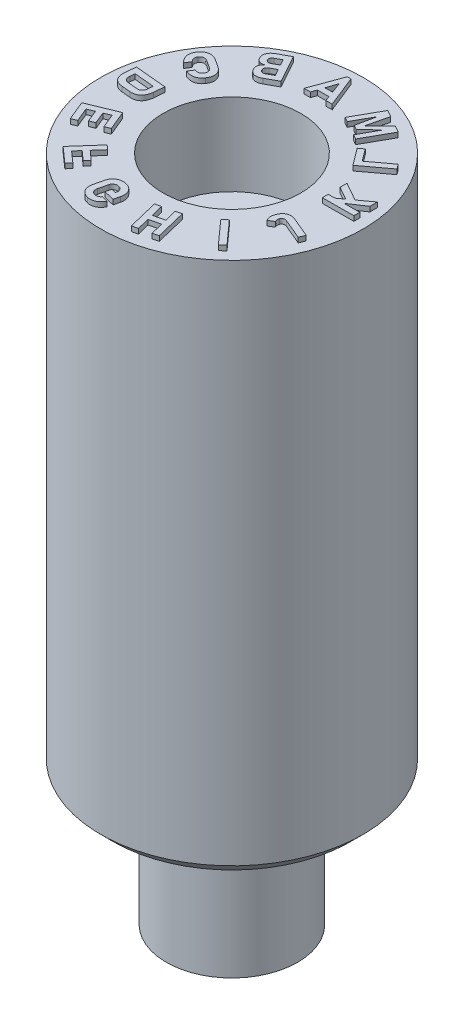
SolidWorks part; units mm, degrees
other "<M8L16-SetScrew>-<Chamfer1>" parameters "D10"=0.75
ref_plane "Front Plane" through (0, 0, 0) normal (0, 0, 1) x (1, 0, 0)
ref_plane "Top Plane" through (0, 0, 0) normal (0, 1, 0) x (1, 0, 0)
ref_plane "Right Plane" through (0, 0, 0) normal (1, 0, 0) x (0, 0, -1)
sketch "Sketch1" plane through (0, 0, 0) normal (0, 0, 1) x (1, 0, 0)
  line L0 (0, 0) -> (0, 20) construction
  line L1 (0, -17.985) -> (0, 17.985) construction
  line L2 (4, -32.7) -> (7.25, -32.7)
  line L4 (8, -31.95) -> (8, 0)
  line L5 (8, 0) -> (4.2, 0)
  line L6 (4.2, 0) -> (4.2, -5)
  line L7 (4.2, -5) -> (1.75, -5)
  line L8 (1.75, -5) -> (1.75, -22.7)
  line L9 (1.75, -22.7) -> (4, -22.7)
  line L10 (4, -22.7) -> (4, -32.7)
  line L11 (7.25, -32.7) -> (8, -31.95)
  point P6 (8, -32.7)
  dimension "D1" = 5
  dimension "D2" = 10
  dimension "D3" = 3.5
  dimension "D4" = 8.4
  dimension "D5" = 16
  dimension "D6" = 8
  dimension "D7" = 32.7
revolve "Revolve1" add sketch "Sketch1" angle 360 about L0
sketch "Sketch2" plane through (0, 0, 0) normal (0, 1, 0) x (1, 0, 0)
  line L0 (0, 0) -> (0, 8.4189) construction
  line L1 (0, 0) -> (3.9125, 7.4546) construction
  line L2 (0, 0) -> (6.9286, 4.7825) construction
  line L3 (0, 0) -> (8.3575, 1.0148) construction
  line L4 (0, 0) -> (7.8718, -2.9854) construction
  line L5 (0, 0) -> (5.5828, -6.3016) construction
  line L6 (0, 0) -> (2.0148, -8.1743) construction
  line L7 (0, 0) -> (-2.0148, -8.1743) construction
  line L8 (0, 0) -> (-5.5828, -6.3016) construction
  line L9 (0, 0) -> (-7.8718, -2.9854) construction
  line L10 (0, 0) -> (-8.3575, 1.0148) construction
  line L11 (0, 0) -> (-6.9286, 4.7825) construction
  line L12 (0, 0) -> (-3.9125, 7.4546) construction
  line L13 (6.1634, 3.8937) -> (5.9474, 4.1837)
  line L14 (5.9474, 4.1837) -> (4.688, 3.2459)
  line L15 (6.1926, 0.7435) -> (5.814, 0.4673)
  line L16 (4.6243, 2.7476) -> (6.1634, 3.8937)
  line L17 (4.6929, 3.2393) -> (4.1361, 3.9867)
  line L18 (4.1361, 3.9867) -> (3.8565, 3.7785)
  line L19 (3.8565, 3.7785) -> (4.6243, 2.7476)
  line L20 (-6.9372, -2.2143) -> (-6.8828, -2.3461)
  line L21 (3.2036, 6.4692) -> (2.7908, 6.7004)
  line L22 (2.7908, 6.7004) -> (1.8593, 5.0371)
  line L23 (1.8593, 5.0371) -> (2.1439, 4.8776)
  line L24 (2.1439, 4.8776) -> (2.8055, 6.0589)
  line L25 (5.814, 0.4673) -> (5.4001, 0.4644)
  line L26 (2.8055, 6.0589) -> (2.5544, 4.8913)
  line L27 (2.5544, 4.8913) -> (2.8312, 4.7363)
  line L28 (2.8312, 4.7363) -> (3.6837, 5.5389)
  line L29 (-2.705, 5.5245) -> (-2.482, 5.1205)
  line L30 (3.6837, 5.5389) -> (3.0342, 4.379)
  line L31 (3.0342, 4.379) -> (3.3188, 4.2196)
  line L32 (3.3188, 4.2196) -> (4.2502, 5.8829)
  line L33 (4.2502, 5.8829) -> (3.8374, 6.114)
  line L34 (3.8374, 6.114) -> (2.8925, 5.1702)
  line L35 (2.8925, 5.1702) -> (3.2036, 6.4692)
  line L36 (0.0051, 7.2452) -> (-0.2234, 7.2417)
  line L37 (-0.2234, 7.2417) -> (-0.9248, 5.3206)
  line L38 (-0.9248, 5.3206) -> (-0.5371, 5.3264)
  line L39 (-0.5371, 5.3264) -> (-0.4346, 5.634)
  line L40 (-0.0999, 6.6378) -> (0.1385, 5.9896)
  line L41 (0.3772, 5.3406) -> (0.7644, 5.3464)
  line L42 (0.7644, 5.3464) -> (0.0051, 7.2452)
  line L43 (0.1385, 5.9896) -> (-0.3183, 5.9827)
  line L44 (-5.2818, 0.7995) -> (-5.2817, 0.7994)
  line L45 (-0.4346, 5.634) -> (0.2654, 5.6446)
  line L46 (0.2654, 5.6446) -> (0.3772, 5.3406)
  line L47 (-2.482, 5.1205) -> (-2.8404, 4.9228)
  line L48 (-3.1778, 4.9966) -> (-3.1797, 5.0001)
  line L49 (-3.0634, 5.3268) -> (-2.705, 5.5245)
  line L50 (-5.7488, -2.1146) -> (-5.3521, -1.9511)
  line L51 (-2.8732, 5.8294) -> (-3.2317, 5.6317)
  line L52 (-3.4303, 5.9921) -> (-3.072, 6.1897)
  line L53 (-6.4787, -2.4153) -> (-6.0699, -2.2469)
  line L54 (-2.924, 6.669) -> (-3.6086, 6.2913)
  line L55 (-3.4724, 4.7776) -> (-3.4705, 4.7741)
  line L56 (-2.702, 4.6013) -> (-1.9976, 4.9899)
  line L57 (-4.1719, -4.468) -> (-3.6712, -3.9037)
  line L58 (-4.7036, -5.0672) -> (-4.4009, -4.7261)
  line L59 (-3.072, 6.1897) -> (-2.8732, 5.8294)
  line L60 (1.9018, -6.1847) -> (2.0889, -6.9547)
  line L61 (-1.9976, 4.9899) -> (-2.924, 6.669)
  line L62 (-4.7021, 3.8426) -> (-5.1435, 4.1295)
  line L63 (-5.9424, 3.0007) -> (-5.7379, 3.3152)
  line L64 (-5.3477, 3.8156) -> (-4.9064, 3.5287)
  line L65 (-5.2067, 2.9698) -> (-5.4111, 2.6553)
  line L66 (-5.6287, 0.8318) -> (-5.6548, 0.5518)
  line L67 (-6.0162, 0.2109) -> (-6.5786, 0.2633)
  line L68 (-6.8711, 0.6655) -> (-6.845, 0.9452)
  line L69 (-7.1581, 1.3375) -> (-7.1751, 1.1562)
  line L70 (-7.1751, 1.1562) -> (-7.2168, 0.7058)
  line L71 (-6.6029, -0.1107) -> (-6.0615, -0.1612)
  line L72 (-5.3071, 0.529) -> (-5.2482, 1.1595)
  line L73 (1.1507, -6.0092) -> (0.9672, -5.2541)
  line L74 (-5.2006, -5.0874) -> (-5.1027, -5.1741)
  line L75 (-6.845, 0.9452) -> (-5.6287, 0.8318)
  line L77 (-5.2482, 1.1595) -> (-7.1581, 1.3375)
  line L79 (-6.8, -2.5476) -> (-6.7998, -2.5476)
  line L81 (-5.1683, -1.4856) -> (-6.9372, -2.2143)
  line L82 (-5.3521, -1.9511) -> (-5.0014, -2.803)
  line L83 (-5.0014, -2.803) -> (-4.6803, -2.6707)
  line L84 (-4.6803, -2.6707) -> (-5.1683, -1.4856)
  line L86 (-6.0699, -2.2469) -> (-5.7743, -2.9647)
  line L87 (-5.7743, -2.9647) -> (-5.4532, -2.8324)
  line L88 (-5.4532, -2.8324) -> (-5.7488, -2.1146)
  line L90 (-6.8875, -2.3345) -> (-6.4491, -3.3994)
  line L91 (-6.4491, -3.3994) -> (-6.128, -3.267)
  line L92 (-6.128, -3.267) -> (-6.4787, -2.4153)
  line L95 (-4.9326, -5.3253) -> (-4.9325, -5.3252)
  line L96 (-3.6712, -3.9037) -> (-3.9393, -3.6658)
  line L97 (-3.9393, -3.6658) -> (-5.2006, -5.0874)
  line L98 (-4.4009, -4.7261) -> (-3.8424, -5.2216)
  line L99 (-3.8424, -5.2216) -> (-3.6134, -4.9633)
  line L100 (-3.6134, -4.9633) -> (-4.1719, -4.468)
  line L102 (-5.1027, -5.1741) -> (-4.2668, -5.9159)
  line L103 (-4.2668, -5.9159) -> (-4.0378, -5.658)
  line L104 (-4.0378, -5.658) -> (-4.7036, -5.0672)
  line L106 (-0.8932, -6.3528) -> (-0.8066, -5.9905)
  line L107 (-2.1537, -5.6247) -> (-2.2847, -6.1722)
  line L108 (-0.9771, -6.6349) -> (-1.3546, -6.5444)
  line L109 (-1.9226, -6.2591) -> (-1.7916, -5.7116)
  line L110 (-1.1675, -5.8989) -> (-1.1749, -5.9295)
  line L111 (-1.1749, -5.9295) -> (-1.4554, -5.862)
  line L112 (-1.4554, -5.862) -> (-1.536, -6.1988)
  line L113 (-1.536, -6.1988) -> (-0.8932, -6.3528)
  line L114 (2.0889, -6.9547) -> (2.44, -6.8695)
  line L115 (2.44, -6.8695) -> (1.9873, -5.0066)
  line L116 (1.9873, -5.0066) -> (1.6362, -5.0917)
  line L117 (1.6362, -5.0917) -> (1.8196, -5.8466)
  line L118 (1.069, -7.2026) -> (1.4199, -7.1171)
  line L119 (1.4199, -7.1171) -> (1.2329, -6.3473)
  line L120 (0.9672, -5.2541) -> (0.6163, -5.3396)
  line L121 (0.6163, -5.3396) -> (1.069, -7.2026)
  line L122 (1.2329, -6.3473) -> (1.9018, -6.1847)
  line L124 (1.8196, -5.8466) -> (1.1507, -6.0092)
  line L126 (3.7361, -3.8924) -> (3.4597, -4.1403)
  line L127 (3.4597, -4.1403) -> (4.7287, -5.5558)
  line L128 (4.7287, -5.5558) -> (5.0051, -5.308)
  line L129 (5.0051, -5.308) -> (3.7361, -3.8924)
  line L130 (4.9148, -2.7745) -> (5.2267, -2.5855)
  line L131 (5.5498, -2.211) -> (6.7531, -2.7157)
  line L132 (6.7531, -2.7157) -> (6.8975, -2.371)
  line L133 (6.8975, -2.371) -> (5.6929, -1.8659)
  line L134 (6.3638, 0.4711) -> (7.3057, 1.1003)
  line L135 (7.3057, 1.1003) -> (7.3025, 1.5534)
  line L136 (7.3025, 1.5534) -> (6.5176, 0.9806)
  line L138 (7.3126, 0.1175) -> (7.3101, 0.4775)
  line L139 (7.3101, 0.4775) -> (6.3638, 0.4711)
  line L140 (5.4001, 0.4644) -> (5.4026, 0.1044)
  line L141 (5.4026, 0.1044) -> (7.3126, 0.1175)
  line L143 (6.5176, 0.9806) -> (5.3919, 1.6205)
  line L144 (5.3919, 1.6205) -> (5.3948, 1.1935)
  line L145 (5.3948, 1.1935) -> (6.1926, 0.7435)
  line L146 (-0.3183, 5.9827) -> (-0.0999, 6.6378)
  circle A0 centre (0, 0) radius 5.405 construction
  spline S0 degree 3 poles (-2.8404, 4.9228) (-2.8729, 4.9052) (-2.9225, 4.8836) (-2.9909, 4.8764) (-3.037, 4.8809) (-3.0797, 4.8957) (-3.1328, 4.9293) (-3.1619, 4.9684) (-3.1778, 4.9966) knots 0 0 0 0 0.284391 0.406925 0.523436 0.636799 0.750157 1 1 1 1
  spline S1 degree 3 poles (-3.1797, 5.0001) (-3.1902, 5.0201) (-3.2046, 5.0505) (-3.2124, 5.093) (-3.2141, 5.1234) (-3.2105, 5.1528) (-3.2034, 5.1818) (-3.19, 5.2093) (-3.1732, 5.2361) (-3.1519, 5.2614) (-3.117, 5.2944) (-3.0855, 5.3143) (-3.0634, 5.3268) knots 0 0 0 0 0.172786 0.252535 0.328511 0.403241 0.477972 0.554742 0.634827 0.718587 0.806354 1 1 1 1
  spline S2 degree 3 poles (-3.2317, 5.6317) (-3.261, 5.616) (-3.306, 5.5961) (-3.3683, 5.5907) (-3.4105, 5.5961) (-3.4499, 5.6106) (-3.4988, 5.6439) (-3.5261, 5.6807) (-3.5411, 5.7076) knots 0 0 0 0 0.277608 0.399007 0.514088 0.628492 0.743694 1 1 1 1
  spline S3 degree 3 poles (-3.5411, 5.7076) (-3.5555, 5.7317) (-3.5687, 5.7713) (-3.5688, 5.8258) (-3.558, 5.8641) (-3.5391, 5.9007) (-3.4997, 5.9485) (-3.4594, 5.9757) (-3.4303, 5.9921) knots 0 0 0 0 0.242864 0.354019 0.467184 0.584636 0.709262 1 1 1 1
  spline S4 degree 3 poles (-3.6086, 6.2913) (-3.659, 6.2631) (-3.7299, 6.217) (-3.8099, 6.1429) (-3.8578, 6.0856) (-3.8962, 6.0256) (-3.9239, 5.9627) (-3.9414, 5.8976) (-3.9483, 5.8305) (-3.9456, 5.7617) (-3.9255, 5.6662) (-3.8969, 5.5968) (-3.8718, 5.5524) knots 0 0 0 0 0.195005 0.283131 0.366486 0.44606 0.522549 0.597223 0.672308 0.74896 0.828127 1 1 1 1
  spline S5 degree 3 poles (-3.8718, 5.5524) (-3.8548, 5.5214) (-3.825, 5.4781) (-3.7764, 5.4297) (-3.7377, 5.3996) (-3.696, 5.3751) (-3.6518, 5.3562) (-3.6047, 5.3441) (-3.5556, 5.3368) (-3.5042, 5.3361) (-3.4317, 5.3434) (-3.3774, 5.3578) (-3.3416, 5.3705) knots 0 0 0 0 0.171962 0.253412 0.332655 0.410313 0.487705 0.565742 0.64596 0.728643 0.814982 1 1 1 1
  spline S6 degree 3 poles (-3.3416, 5.3705) (-3.3738, 5.3463) (-3.4185, 5.307) (-3.4667, 5.2462) (-3.4951, 5.199) (-3.517, 5.15) (-3.5319, 5.0994) (-3.5396, 5.0476) (-3.5399, 4.9946) (-3.5338, 4.9407) (-3.5156, 4.8662) (-3.4921, 4.8123) (-3.4724, 4.7776) knots 0 0 0 0 0.180015 0.263899 0.345612 0.425257 0.503012 0.580312 0.658618 0.73897 0.822146 1 1 1 1
  spline S7 degree 3 poles (-3.4705, 4.7741) (-3.4462, 4.7287) (-3.4025, 4.6669) (-3.3313, 4.5989) (-3.2744, 4.5593) (-3.2136, 4.5288) (-3.1488, 4.5091) (-3.0805, 4.499) (-3.0091, 4.4996) (-2.935, 4.51) (-2.8294, 4.5378) (-2.7528, 4.5739) (-2.702, 4.6013) knots 0 0 0 0 0.172506 0.25189 0.329007 0.404278 0.479136 0.555323 0.634771 0.717862 0.805936 1 1 1 1
  spline S8 degree 3 poles (-4.4809, 2.8701) (-4.4618, 2.8998) (-4.435, 2.9445) (-4.4056, 3.0063) (-4.3873, 3.0516) (-4.3719, 3.0965) (-4.36, 3.1414) (-4.3513, 3.1859) (-4.3461, 3.2302) (-4.3444, 3.2739) (-4.3455, 3.3172) (-4.3499, 3.3598) (-4.3581, 3.4018) (-4.3684, 3.4434) (-4.3835, 3.4839) (-4.4006, 3.5241) (-4.4217, 3.5633) (-4.4456, 3.6019) (-4.473, 3.6394) (-4.5033, 3.676) (-4.5371, 3.7113) (-4.5737, 3.7457) (-4.6276, 3.7914) (-4.6716, 3.8225) (-4.7021, 3.8426) knots 0 0 0 0 0.093463 0.13776 0.180719 0.222737 0.263257 0.303434 0.342516 0.381193 0.419051 0.456928 0.494305 0.53222 0.570071 0.60851 0.64773 0.687578 0.728638 0.770358 0.813344 0.857642 0.903384 1 1 1 1
  spline S9 degree 3 poles (-5.1435, 4.1295) (-5.1741, 4.1493) (-5.2204, 4.1764) (-5.2835, 4.2079) (-5.33, 4.2271) (-5.376, 4.2434) (-5.4216, 4.2566) (-5.4669, 4.2664) (-5.5119, 4.2728) (-5.5564, 4.2762) (-5.6003, 4.2758) (-5.6433, 4.2727) (-5.6856, 4.2657) (-5.7272, 4.2558) (-5.7681, 4.2427) (-5.8083, 4.2267) (-5.8476, 4.2069) (-5.8862, 4.1844) (-5.9234, 4.1582) (-5.9597, 4.1294) (-5.9947, 4.0971) (-6.0286, 4.0619) (-6.0734, 4.0103) (-6.1036, 3.9677) (-6.1228, 3.9381) knots 0 0 0 0 0.096385 0.14194 0.186354 0.229312 0.270957 0.311721 0.351799 0.391094 0.429658 0.467531 0.505147 0.542832 0.580455 0.618564 0.657372 0.696739 0.736574 0.77735 0.819339 0.862281 0.906638 1 1 1 1
  spline S10 degree 3 poles (-6.1228, 3.9381) (-6.1547, 3.8903) (-6.1929, 3.8138) (-6.2238, 3.706) (-6.2357, 3.6253) (-6.2362, 3.5442) (-6.2266, 3.4631) (-6.205, 3.3826) (-6.1733, 3.3026) (-6.1307, 3.2239) (-6.0591, 3.1179) (-5.9913, 3.0464) (-5.9424, 3.0007) knots 0 0 0 0 0.164334 0.242611 0.319849 0.396926 0.474186 0.552786 0.634517 0.719755 0.808368 1 1 1 1
  spline S11 degree 3 poles (-5.7379, 3.3152) (-5.7589, 3.3374) (-5.7894, 3.3709) (-5.8199, 3.4211) (-5.8387, 3.4577) (-5.8524, 3.4945) (-5.8621, 3.5313) (-5.8667, 3.5679) (-5.8673, 3.6043) (-5.8622, 3.6398) (-5.8507, 3.6872) (-5.8325, 3.7198) (-5.8197, 3.7409) knots 0 0 0 0 0.195251 0.286064 0.372826 0.456336 0.53585 0.614195 0.69071 0.766302 0.842097 1 1 1 1
  spline S12 degree 3 poles (-5.8197, 3.7409) (-5.8026, 3.7675) (-5.7736, 3.8038) (-5.7271, 3.8422) (-5.6911, 3.8645) (-5.6529, 3.8801) (-5.6129, 3.8897) (-5.5713, 3.8924) (-5.5281, 3.8898) (-5.4838, 3.8807) (-5.4218, 3.8588) (-5.377, 3.8345) (-5.3477, 3.8156) knots 0 0 0 0 0.174431 0.254798 0.332169 0.407483 0.481873 0.558076 0.637286 0.72005 0.807304 1 1 1 1
  spline S13 degree 3 poles (-4.9064, 3.5287) (-4.877, 3.5099) (-4.837, 3.4786) (-4.7921, 3.4306) (-4.7659, 3.3939) (-4.7458, 3.3558) (-4.7321, 3.3164) (-4.7251, 3.2761) (-4.7238, 3.2349) (-4.7294, 3.193) (-4.7458, 3.1351) (-4.7672, 3.0938) (-4.7845, 3.0674) knots 0 0 0 0 0.192694 0.279911 0.362734 0.441899 0.517589 0.59232 0.667679 0.745034 0.825132 1 1 1 1
  spline S14 degree 3 poles (-4.7845, 3.0674) (-4.7984, 3.0464) (-4.8219, 3.0171) (-4.8604, 2.9861) (-4.891, 2.9668) (-4.9241, 2.9518) (-4.9592, 2.9408) (-4.9965, 2.9349) (-5.0356, 2.9327) (-5.0764, 2.9354) (-5.1347, 2.944) (-5.1778, 2.9587) (-5.2067, 2.9698) knots 0 0 0 0 0.159918 0.23573 0.312147 0.388639 0.465659 0.544653 0.627438 0.713513 0.803401 1 1 1 1
  spline S15 degree 3 poles (-5.4111, 2.6553) (-5.3494, 2.6293) (-5.2563, 2.597) (-5.1304, 2.5739) (-5.0414, 2.5673) (-4.9554, 2.5705) (-4.8732, 2.5837) (-4.7949, 2.6072) (-4.7213, 2.6409) (-4.6522, 2.6838) (-4.5662, 2.7557) (-4.5123, 2.8219) (-4.4809, 2.8701) knots 0 0 0 0 0.192087 0.280572 0.365641 0.447159 0.526249 0.603362 0.680243 0.757504 0.835454 1 1 1 1
  spline S16 degree 3 poles (-5.6548, 0.5518) (-5.6576, 0.5239) (-5.6632, 0.4832) (-5.6771, 0.4317) (-5.6899, 0.397) (-5.7051, 0.365) (-5.7225, 0.3356) (-5.7424, 0.3087) (-5.7654, 0.2853) (-5.7897, 0.2642) (-5.8167, 0.2471) (-5.8451, 0.2325) (-5.8756, 0.2213) (-5.9081, 0.2142) (-5.955, 0.2075) (-5.9916, 0.2089) (-6.0162, 0.2109) knots 0 0 0 0 0.149035 0.217495 0.283219 0.345246 0.40543 0.464615 0.52235 0.579189 0.635258 0.691782 0.748642 0.807291 0.868322 1 1 1 1
  spline S17 degree 3 poles (-6.5786, 0.2633) (-6.6033, 0.2657) (-6.6393, 0.2718) (-6.6846, 0.286) (-6.715, 0.2998) (-6.7432, 0.316) (-6.7685, 0.3356) (-6.7914, 0.3579) (-6.8119, 0.3827) (-6.8292, 0.4104) (-6.8444, 0.4401) (-6.8563, 0.4723) (-6.8647, 0.5067) (-6.8712, 0.5432) (-6.8748, 0.5965) (-6.8737, 0.6376) (-6.8711, 0.6655) knots 0 0 0 0 0.131672 0.192754 0.251556 0.308635 0.365003 0.421164 0.477868 0.535369 0.594329 0.65457 0.716817 0.782193 0.85136 1 1 1 1
  spline S18 degree 3 poles (-7.2168, 0.7058) (-7.2205, 0.6673) (-7.2236, 0.6104) (-7.222, 0.5358) (-7.2182, 0.4828) (-7.2113, 0.4319) (-7.2025, 0.3828) (-7.1901, 0.3358) (-7.1758, 0.2906) (-7.1585, 0.2476) (-7.1383, 0.2071) (-7.1161, 0.1684) (-7.0911, 0.1323) (-7.0632, 0.0987) (-7.0331, 0.0673) (-7.0004, 0.0381) (-6.9653, 0.0113) (-6.9279, -0.0132) (-6.888, -0.035) (-6.8457, -0.0537) (-6.8018, -0.0711) (-6.7551, -0.0846) (-6.6891, -0.1004) (-6.6377, -0.1072) (-6.6029, -0.1107) knots 0 0 0 0 0.099749 0.146985 0.19273 0.236796 0.279533 0.321342 0.362111 0.401882 0.440873 0.478878 0.517013 0.554113 0.591573 0.629144 0.667045 0.70549 0.744579 0.784227 0.824764 0.866529 0.909453 1 1 1 1
  spline S19 degree 3 poles (-6.0615, -0.1612) (-6.0282, -0.1644) (-5.9786, -0.1669) (-5.9137, -0.1632) (-5.867, -0.1587) (-5.8216, -0.1511) (-5.7778, -0.14) (-5.7353, -0.1267) (-5.6941, -0.1106) (-5.6545, -0.0916) (-5.617, -0.0694) (-5.581, -0.0451) (-5.5472, -0.0174) (-5.5152, 0.0131) (-5.4853, 0.0467) (-5.4569, 0.0828) (-5.4307, 0.1218) (-5.4067, 0.1637) (-5.3847, 0.208) (-5.3658, 0.2552) (-5.349, 0.3048) (-5.3344, 0.357) (-5.3183, 0.4316) (-5.3109, 0.4895) (-5.3071, 0.529) knots 0 0 0 0 0.086481 0.127898 0.168129 0.207826 0.246558 0.28498 0.322959 0.36087 0.398205 0.435686 0.473057 0.511042 0.549878 0.58919 0.629761 0.671353 0.713841 0.757659 0.802731 0.849202 0.89753 1 1 1 1
  spline S20 degree 3 poles (-0.8066, -5.9905) (-0.7988, -5.957) (-0.789, -5.9069) (-0.7823, -5.8401) (-0.7807, -5.7916) (-0.7816, -5.7441) (-0.7853, -5.6974) (-0.7924, -5.6516) (-0.8021, -5.6068) (-0.8152, -5.5634) (-0.8304, -5.5213) (-0.8488, -5.4811) (-0.8697, -5.4425) (-0.8934, -5.4057) (-0.92, -5.3709) (-0.949, -5.3374) (-0.9807, -5.3058) (-1.0152, -5.2765) (-1.0513, -5.2487) (-1.0902, -5.2243) (-1.1307, -5.2011) (-1.1739, -5.1814) (-1.2346, -5.1567) (-1.2826, -5.1434) (-1.3152, -5.1353) knots 0 0 0 0 0.092121 0.136285 0.179439 0.22189 0.263478 0.304577 0.345655 0.386153 0.425761 0.465192 0.504379 0.543051 0.582206 0.62141 0.661508 0.701945 0.742296 0.783348 0.824655 0.867092 0.910102 1 1 1 1
  spline S21 degree 3 poles (-1.3152, -5.1353) (-1.348, -5.1277) (-1.3971, -5.1177) (-1.4627, -5.1115) (-1.5103, -5.1089) (-1.557, -5.1105) (-1.6029, -5.1138) (-1.648, -5.1207) (-1.6919, -5.1304) (-1.7347, -5.1423) (-1.7757, -5.1575) (-1.8152, -5.1752) (-1.8534, -5.1944) (-1.889, -5.218) (-1.9235, -5.2433) (-1.9563, -5.2713) (-1.9873, -5.3017) (-2.0159, -5.3349) (-2.0429, -5.3699) (-2.0672, -5.4071) (-2.0893, -5.4465) (-2.109, -5.4879) (-2.132, -5.547) (-2.1464, -5.593) (-2.1537, -5.6247) knots 0 0 0 0 0.092552 0.137046 0.180663 0.223092 0.265247 0.306893 0.348012 0.388535 0.428649 0.468017 0.507012 0.545873 0.585053 0.624255 0.664008 0.704082 0.744404 0.785108 0.826043 0.868118 0.91081 1 1 1 1
  spline S22 degree 3 poles (-2.2847, -6.1722) (-2.2927, -6.2055) (-2.3021, -6.2557) (-2.3089, -6.3224) (-2.3111, -6.371) (-2.3097, -6.4185) (-2.3057, -6.4652) (-2.2992, -6.5109) (-2.2888, -6.5555) (-2.2764, -6.599) (-2.2608, -6.6407) (-2.2424, -6.6807) (-2.222, -6.7194) (-2.1979, -6.7558) (-2.1716, -6.791) (-2.1424, -6.8242) (-2.1109, -6.8558) (-2.0767, -6.8852) (-2.0402, -6.9123) (-2.0014, -6.937) (-1.961, -6.96) (-1.9177, -6.9798) (-1.857, -7.0046) (-1.8088, -7.0177) (-1.7763, -7.026) knots 0 0 0 0 0.091895 0.136427 0.179473 0.222144 0.263488 0.304909 0.34577 0.386066 0.42598 0.464967 0.503906 0.542926 0.581807 0.62138 0.661188 0.701329 0.742019 0.782769 0.824469 0.866606 0.910008 1 1 1 1
  spline S23 degree 3 poles (-1.7763, -7.026) (-1.7227, -7.0387) (-1.6412, -7.0495) (-1.5328, -7.0454) (-1.4539, -7.0327) (-1.3777, -7.0111) (-1.305, -6.9811) (-1.2365, -6.9424) (-1.1725, -6.8952) (-1.1134, -6.8407) (-1.0432, -6.7566) (-0.9999, -6.6858) (-0.9771, -6.6349) knots 0 0 0 0 0.170555 0.253199 0.335753 0.417672 0.498082 0.57901 0.661073 0.744136 0.827441 1 1 1 1
  spline S24 degree 3 poles (-1.3546, -6.5444) (-1.3655, -6.5621) (-1.385, -6.5865) (-1.416, -6.614) (-1.4418, -6.6314) (-1.4694, -6.6462) (-1.4988, -6.6573) (-1.5293, -6.6665) (-1.561, -6.6717) (-1.5933, -6.6745) (-1.6364, -6.6731) (-1.6685, -6.6696) (-1.6893, -6.6639) knots 0 0 0 0 0.163572 0.245277 0.326873 0.409034 0.491977 0.574604 0.659926 0.745782 0.830139 1 1 1 1
  spline S25 degree 3 poles (-1.6893, -6.6639) (-1.7188, -6.6571) (-1.7609, -6.6416) (-1.8115, -6.6119) (-1.844, -6.5849) (-1.8723, -6.5543) (-1.8957, -6.5201) (-1.9134, -6.4823) (-1.9264, -6.4417) (-1.934, -6.3985) (-1.9368, -6.3369) (-1.9304, -6.2901) (-1.9226, -6.2591) knots 0 0 0 0 0.172377 0.253781 0.333557 0.41237 0.490427 0.568834 0.649394 0.733016 0.817997 1 1 1 1
  spline S26 degree 3 poles (-1.7916, -5.7116) (-1.7848, -5.6842) (-1.7711, -5.6445) (-1.7418, -5.5981) (-1.7163, -5.5676) (-1.6868, -5.5415) (-1.6538, -5.5201) (-1.6178, -5.503) (-1.5784, -5.492) (-1.5368, -5.4853) (-1.4774, -5.4834) (-1.4322, -5.4904) (-1.4022, -5.4974) knots 0 0 0 0 0.169329 0.248773 0.328065 0.406517 0.484086 0.563088 0.644456 0.728129 0.814936 1 1 1 1
  spline S27 degree 3 poles (-1.4022, -5.4974) (-1.3722, -5.5042) (-1.3296, -5.5195) (-1.2784, -5.549) (-1.2456, -5.5751) (-1.2171, -5.6049) (-1.1938, -5.6384) (-1.1755, -5.6753) (-1.1629, -5.7156) (-1.1552, -5.7583) (-1.1531, -5.8202) (-1.16, -5.8674) (-1.1675, -5.8989) knots 0 0 0 0 0.174919 0.256357 0.335927 0.41363 0.490415 0.56802 0.64759 0.73023 0.814886 1 1 1 1
  spline S28 degree 3 poles (4.8776, -2.1862) (4.8557, -2.2375) (4.8312, -2.3166) (4.8176, -2.424) (4.8177, -2.5014) (4.8276, -2.5761) (4.8525, -2.6707) (4.8868, -2.7355) (4.9148, -2.7745) knots 0 0 0 0 0.2717 0.400328 0.52538 0.647532 0.76606 1 1 1 1
  spline S29 degree 3 poles (5.2267, -2.5855) (5.2141, -2.5638) (5.2003, -2.529) (5.1884, -2.4808) (5.184, -2.4443) (5.1834, -2.4078) (5.1892, -2.3601) (5.1981, -2.3252) (5.2079, -2.3033) knots 0 0 0 0 0.255934 0.381892 0.508039 0.632242 0.755256 1 1 1 1
  spline S30 degree 3 poles (5.2079, -2.3033) (5.2201, -2.2745) (5.2453, -2.2339) (5.2956, -2.1981) (5.3381, -2.1814) (5.3856, -2.1743) (5.4584, -2.1788) (5.5134, -2.1951) (5.5498, -2.211) knots 0 0 0 0 0.23603 0.345273 0.457144 0.574709 0.702597 1 1 1 1
  spline S31 degree 3 poles (5.6929, -1.8659) (5.6634, -1.8535) (5.619, -1.8375) (5.5597, -1.8201) (5.5166, -1.8106) (5.4743, -1.8037) (5.4328, -1.7996) (5.3922, -1.7983) (5.3523, -1.7998) (5.3134, -1.8039) (5.2756, -1.8111) (5.2389, -1.8203) (5.2035, -1.8331) (5.1691, -1.848) (5.1357, -1.8654) (5.104, -1.8863) (5.0729, -1.9089) (5.0437, -1.9351) (5.0151, -1.963) (4.9883, -1.9941) (4.9635, -2.0278) (4.9393, -2.0635) (4.9094, -2.1159) (4.8896, -2.1574) (4.8776, -2.1862) knots 0 0 0 0 0.096275 0.141902 0.185988 0.229024 0.270622 0.311502 0.351298 0.390755 0.428987 0.466961 0.504517 0.542225 0.579777 0.617687 0.656344 0.695463 0.735684 0.776415 0.818662 0.861701 0.906224 1 1 1 1
  point P16 (0, 0)
  point P17 (0, 0)
  point P21 (0, 0)
  dimension "D1" = 10.81
  dimension "D2" = 13
extrude "Boss-Extrude1" add sketch "Sketch2" along normal blind 0.3
inserted part "M8L16-SetScrew"
move or copy body "Body-Move/Copy2" placed by mates yes
other "Distance1" parameters "D1"=8
